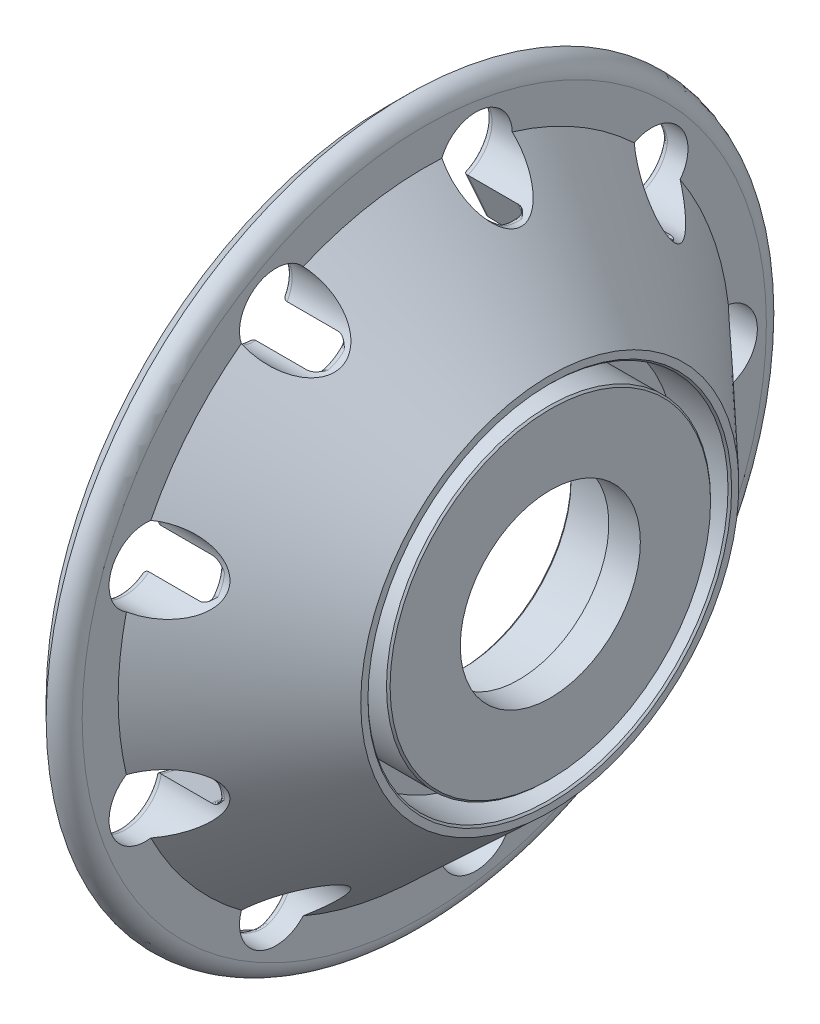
SolidWorks part; units mm, degrees
ref_plane "Plan de face" through (0, 0, 0) normal (0, 0, 1) x (1, 0, 0)
ref_plane "Plan de dessus" through (0, 0, 0) normal (0, 1, 0) x (1, 0, 0)
ref_plane "Plan de droite" through (0, 0, 0) normal (1, 0, 0) x (0, 0, -1)
ref_plane "Plan1" through (0, 0, 0) normal (0, 0, -1) x (-1, 0, 0)
sketch "Esquisse1" plane through (0, 0, 0) normal (0, 0, -1) x (-1, 0, 0)
  line L0 (0.0592, 21) -> (0.0592, 0)
  line L1 (0.0592, 0) -> (18, 0)
  line L2 (18, 0) -> (18, 38)
  line L3 (18, 38) -> (16, 40)
  line L4 (14, 38) -> (14, 34)
  line L5 (14, 34) -> (0.0592, 21)
  line L6 (0.0592, 0) -> (18, 0) construction
  arc A0 (16, 40) -> (14, 38) centre (16, 38) ccw
revolve "Révolution1" add sketch "Esquisse1" angle 360 about L6
sketch "Esquisse2" plane through (-18, 0, 0) normal (-1, 0, 0) x (0, 0, 1)
  line L0 (12.984, 26.489) -> (7.5426, 23.835)
  line L1 (7.5426, 23.835) -> (1.0643, 24.9773)
  line L2 (1.0643, 24.9773) -> (-3.1412, 29.3323)
  line L3 (-7.0805, 28.6377) -> (-9.5429, 23.107)
  line L4 (-9.5429, 23.107) -> (-15.2398, 19.8179)
  line L5 (-15.2398, 19.8179) -> (-21.2607, 20.4507)
  line L6 (-23.8319, 17.3865) -> (-22.1632, 11.567)
  line L7 (-22.1632, 11.567) -> (-24.4131, 5.3854)
  line L8 (-24.4131, 5.3854) -> (-29.4321, 2)
  line L9 (-29.4321, -2) -> (-24.4131, -5.3854)
  line L10 (-24.4131, -5.3854) -> (-22.1632, -11.567)
  line L11 (-22.1632, -11.567) -> (-23.8319, -17.3865)
  line L12 (-21.2607, -20.4507) -> (-15.2398, -19.8179)
  line L13 (-15.2398, -19.8179) -> (-9.5429, -23.107)
  line L14 (-9.5429, -23.107) -> (-7.0805, -28.6377)
  line L15 (-3.1412, -29.3323) -> (1.0643, -24.9773)
  line L16 (1.0643, -24.9773) -> (7.5426, -23.835)
  line L17 (7.5426, -23.835) -> (12.984, -26.489)
  line L18 (16.4481, -24.489) -> (16.8704, -18.4496)
  line L19 (16.8704, -18.4496) -> (21.0989, -13.4104)
  line L20 (21.0989, -13.4104) -> (26.9731, -11.9458)
  line L21 (28.3412, -8.187) -> (24.7827, -3.2891)
  line L22 (24.7827, -3.2891) -> (24.7827, 3.2891)
  line L23 (24.7827, 3.2891) -> (28.3412, 8.187)
  line L24 (26.9731, 11.9458) -> (21.0989, 13.4104)
  line L25 (21.0989, 13.4104) -> (16.8704, 18.4496)
  line L26 (16.8704, 18.4496) -> (16.4481, 24.489)
  arc A0 (-3.1412, 29.3323) -> (-7.0805, 28.6377) centre (-5.722, 32.4512) cw
  arc A1 (-21.2607, 20.4507) -> (-23.8319, 17.3865) centre (-25.2425, 21.181) cw
  arc A2 (-29.4321, 2) -> (-29.4321, -2) centre (-32.9518, 0) cw
  arc A3 (-23.8319, -17.3865) -> (-21.2607, -20.4507) centre (-25.2425, -21.181) cw
  arc A4 (-7.0805, -28.6377) -> (-3.1412, -29.3323) centre (-5.722, -32.4512) cw
  arc A5 (12.984, -26.489) -> (16.4481, -24.489) centre (16.4759, -28.5371) cw
  arc A6 (26.9731, -11.9458) -> (28.3412, -8.187) centre (30.9646, -11.2702) cw
  arc A7 (28.3412, 8.187) -> (26.9731, 11.9458) centre (30.9646, 11.2702) cw
  arc A8 (16.4481, 24.489) -> (12.984, 26.489) centre (16.4759, 28.5371) cw
extrude "Extrusion1" cut sketch "Esquisse2" against normal blind 8
draft "Dépouille1" type of draft neutral plane draft angle 2 faces to draft 9 parameters "D1"=2
ref_plane "Plan2" through (0, 28.5371, 0) normal (0, 1, 0) x (-1, 0, 0)
sketch "Esquisse3" plane through (0, 28.5371, 0) normal (0, 1, 0) x (-1, 0, 0)
  line L0 (8.5348, 16.4759) -> (8.5348, 12.4277)
  line L1 (8.5348, 12.4277) -> (14, 12.4277)
  line L2 (14, 12.4277) -> (14, 16.4759)
  line L3 (14, 16.4759) -> (8.5348, 16.4759)
  line L4 (14, 16.4759) -> (8.5348, 16.4759) construction
revolve "Révolution2" add sketch "Esquisse3" angle 360 about L3
ref_plane "Plan3" through (0, 0, 0) normal (0, 0.9397, 0.342) x (-1, 0, 0)
sketch "Esquisse4" plane through (0, 0, 0) normal (0, 0.9397, 0.342) x (-1, 0, 0)
  line L0 (8.5348, 37) -> (8.5348, 32.9518)
  line L1 (8.5348, 32.9518) -> (14, 32.9518)
  line L2 (14, 32.9518) -> (14, 37)
  line L3 (14, 37) -> (8.5348, 37)
  line L4 (8.5348, 32.9518) -> (14, 32.9518) construction
revolve "Révolution3" add sketch "Esquisse4" angle 360 about L1
ref_plane "Plan4" through (0, 0, 0) normal (0, 0.5, 0.866) x (1, 0, 0)
sketch "Esquisse5" plane through (0, 0, 0) normal (0, 0.5, 0.866) x (1, 0, 0)
  line L0 (-8.5348, -37) -> (-8.5348, -32.9518)
  line L1 (-8.5348, -32.9518) -> (-14, -32.9518)
  line L2 (-14, -32.9518) -> (-14, -37)
  line L3 (-14, -37) -> (-8.5348, -37)
  line L4 (-8.5348, -32.9518) -> (-14, -32.9518) construction
revolve "Révolution4" add sketch "Esquisse5" angle 360 about L4
ref_plane "Plan5" through (0, 0, 0) normal (0, -0.1736, 0.9848) x (1, 0, 0)
sketch "Esquisse6" plane through (0, 0, 0) normal (0, -0.1736, 0.9848) x (1, 0, 0)
  line L0 (-8.5348, -37) -> (-8.5348, -32.9518)
  line L1 (-8.5348, -32.9518) -> (-14, -32.9518)
  line L2 (-14, -32.9518) -> (-14, -37)
  line L3 (-14, -37) -> (-8.5348, -37)
  line L4 (-8.5348, -32.9518) -> (-14, -32.9518) construction
revolve "Révolution5" add sketch "Esquisse6" angle 360 about L1
ref_plane "Plan6" through (0, 0, 0) normal (0, 0.766, -0.6428) x (-1, 0, 0)
sketch "Esquisse7" plane through (0, 0, 0) normal (0, 0.766, -0.6428) x (-1, 0, 0)
  line L0 (8.5348, -28.9036) -> (8.5348, -32.9518)
  line L1 (8.5348, -32.9518) -> (14, -32.9518)
  line L2 (14, -32.9518) -> (14, -28.9036)
  line L3 (14, -28.9036) -> (8.5348, -28.9036)
  line L4 (8.5348, -32.9518) -> (14, -32.9518) construction
revolve "Révolution6" add sketch "Esquisse7" angle 360 about L1
sketch "Esquisse8" plane through (0, 0, 0) normal (0, 1, 0) x (1, 0, 0)
  line L0 (-8.5348, 32.9518) -> (-8.5348, 37)
  line L1 (-8.5348, 37) -> (-14, 37)
  line L2 (-14, 37) -> (-14, 32.9518)
  line L3 (-14, 32.9518) -> (-8.5348, 32.9518)
  line L4 (-14, 32.9518) -> (-8.5348, 32.9518) construction
revolve "Révolution7" add sketch "Esquisse8" angle 360 about L3
ref_plane "Plan7" through (0, 0, 0) normal (0, 0.766, 0.6428) x (-1, 0, 0)
sketch "Esquisse9" plane through (0, 0, 0) normal (0, 0.766, 0.6428) x (-1, 0, 0)
  line L0 (8.5348, -32.9518) -> (8.5348, -37)
  line L1 (8.5348, -37) -> (14, -37)
  line L2 (14, -37) -> (14, -32.9518)
  line L3 (14, -32.9518) -> (8.5348, -32.9518)
  line L4 (14, -32.9518) -> (8.5348, -32.9518) construction
revolve "Révolution8" add sketch "Esquisse9" angle 360 about L3
ref_plane "Plan8" through (0, 0, 0) normal (0, 0.1736, 0.9848) x (1, 0, 0)
sketch "Esquisse10" plane through (0, 0, 0) normal (0, 0.1736, 0.9848) x (1, 0, 0)
  line L0 (-8.5348, 28.9036) -> (-8.5348, 32.9518)
  line L1 (-8.5348, 32.9518) -> (-14, 32.9518)
  line L2 (-14, 32.9518) -> (-14, 28.9036)
  line L3 (-14, 28.9036) -> (-8.5348, 28.9036)
  line L4 (-8.5348, 32.9518) -> (-14, 32.9518) construction
revolve "Révolution9" add sketch "Esquisse10" angle 360 about L4
ref_plane "Plan9" through (0, 0, 0) normal (0, 0.9397, -0.342) x (-1, 0, 0)
sketch "Esquisse11" plane through (0, 0, 0) normal (0, 0.9397, -0.342) x (-1, 0, 0)
  line L0 (8.5348, 37) -> (8.5348, 32.9518)
  line L1 (8.5348, 32.9518) -> (14, 32.9518)
  line L2 (14, 32.9518) -> (14, 37)
  line L3 (14, 37) -> (8.5348, 37)
  line L4 (8.5348, 32.9518) -> (14, 32.9518) construction
revolve "Révolution10" add sketch "Esquisse11" angle 360 about L1
hole_wizard "Perçage1" positions "Esquisse13" profile "Esquisse12" legacy
sketch "Esquisse13" plane through (-0.0592, 0, 0) normal (1, 0, 0) x (0, 0, -1)
  point P0 (0, 0)
sketch "Esquisse12" plane through (-0.0592, 0, 0) normal (0, 1, 0) x (0, 0, -1)
  line L0 (0, 0) -> (0, 5.9408)
  line L1 (0, 5.9408) -> (20, 5.9408)
  line L2 (20, 5.9408) -> (20, 0)
  line L3 (20, 0) -> (0, 0)
  line L4 (0, 110) -> (0, -10) construction
  dimension "Diamètre" = 40
  dimension "Profondeur" = 5.9408
sketch "Esquisse14" plane through (0, 0, 0) normal (0, 1, 0) x (1, 0, 0)
  line L0 (-18, 37) -> (-18, 0)
  line L1 (-18, 0) -> (-17, 0)
  line L2 (-17, 0) -> (-17, 37)
  line L3 (-17, 37) -> (-18, 37)
  line L4 (-18, 0) -> (-17, 0) construction
revolve "Enlèvement de matière-Révolution1" cut sketch "Esquisse14" angle 360 about L1
ref_plane "Plan10" through (0, 0, 16.4759) normal (0, 0, 1) x (1, 0, 0)
sketch "Esquisse15" plane through (0, 0, 16.4759) normal (0, 0, 1) x (1, 0, 0)
  line L0 (-17, 32.5853) -> (-17, 28.5371)
  line L1 (-17, 28.5371) -> (-8.5348, 28.5371)
  line L2 (-8.5348, 28.5371) -> (-8.5348, 32.5853)
  line L3 (-8.5348, 32.5853) -> (-17, 32.5853)
  line L4 (-17, 28.5371) -> (-8.5348, 28.5371) construction
revolve "Enlèvement de matière-Révolution2" cut sketch "Esquisse15" angle 360 about L1
ref_plane "Plan11" through (0, 0, 30.9646) normal (0, 0, 1) x (1, 0, 0)
sketch "Esquisse16" plane through (0, 0, 30.9646) normal (0, 0, 1) x (1, 0, 0)
  line L0 (-17, 15.3184) -> (-17, 11.2702)
  line L1 (-17, 11.2702) -> (-8.5348, 11.2702)
  line L2 (-8.5348, 11.2702) -> (-8.5348, 15.3184)
  line L3 (-8.5348, 15.3184) -> (-17, 15.3184)
  line L4 (-17, 11.2702) -> (-8.5348, 11.2702) construction
revolve "Enlèvement de matière-Révolution3" cut sketch "Esquisse16" angle 360 about L1
ref_plane "Plan12" through (0, 0, 30.9646) normal (0, 0, 1) x (1, 0, 0)
sketch "Esquisse17" plane through (0, 0, 30.9646) normal (0, 0, 1) x (1, 0, 0)
  line L0 (-17, -7.222) -> (-17, -11.2702)
  line L1 (-17, -11.2702) -> (-8.5348, -11.2702)
  line L2 (-8.5348, -11.2702) -> (-8.5348, -7.222)
  line L3 (-8.5348, -7.222) -> (-17, -7.222)
  line L4 (-17, -11.2702) -> (-8.5348, -11.2702) construction
revolve "Enlèvement de matière-Révolution4" cut sketch "Esquisse17" angle 360 about L1
ref_plane "Plan13" through (0, 0, 16.4759) normal (0, 0, 1) x (1, 0, 0)
sketch "Esquisse18" plane through (0, 0, 16.4759) normal (0, 0, 1) x (1, 0, 0)
  line L0 (-17, -24.4889) -> (-17, -28.5371)
  line L1 (-17, -28.5371) -> (-8.5348, -28.5371)
  line L2 (-8.5348, -28.5371) -> (-8.5348, -24.4889)
  line L3 (-8.5348, -24.4889) -> (-17, -24.4889)
  line L4 (-17, -28.5371) -> (-8.5348, -28.5371) construction
revolve "Enlèvement de matière-Révolution5" cut sketch "Esquisse18" angle 360 about L1
ref_plane "Plan14" through (0, 0, -5.722) normal (0, 0, 1) x (1, 0, 0)
sketch "Esquisse19" plane through (0, 0, -5.722) normal (0, 0, 1) x (1, 0, 0)
  line L0 (-17, -28.403) -> (-17, -32.4512)
  line L1 (-17, -32.4512) -> (-8.5348, -32.4512)
  line L2 (-8.5348, -32.4512) -> (-8.5348, -28.403)
  line L3 (-8.5348, -28.403) -> (-17, -28.403)
  line L4 (-17, -32.4512) -> (-8.5348, -32.4512) construction
revolve "Enlèvement de matière-Révolution6" cut sketch "Esquisse19" angle 360 about L1
ref_plane "Plan15" through (0, 0, -25.2425) normal (0, 0, 1) x (1, 0, 0)
sketch "Esquisse20" plane through (0, 0, -25.2425) normal (0, 0, 1) x (1, 0, 0)
  line L0 (-17, -17.1328) -> (-17, -21.181)
  line L1 (-17, -21.181) -> (-8.5348, -21.181)
  line L2 (-8.5348, -21.181) -> (-8.5348, -17.1328)
  line L3 (-8.5348, -17.1328) -> (-17, -17.1328)
  line L4 (-17, -21.181) -> (-8.5348, -21.181) construction
revolve "Enlèvement de matière-Révolution7" cut sketch "Esquisse20" angle 360 about L1
ref_plane "Plan16" through (0, 0, -32.9518) normal (0, 0, 1) x (1, 0, 0)
sketch "Esquisse21" plane through (0, 0, -32.9518) normal (0, 0, 1) x (1, 0, 0)
  line L0 (-17, 4.0482) -> (-17, 0)
  line L1 (-17, 0) -> (-8.5348, 0)
  line L2 (-8.5348, 0) -> (-8.5348, 4.0482)
  line L3 (-8.5348, 4.0482) -> (-17, 4.0482)
  line L4 (-17, 0) -> (-8.5348, 0) construction
revolve "Enlèvement de matière-Révolution8" cut sketch "Esquisse21" angle 360 about L1
ref_plane "Plan17" through (0, 0, -25.2425) normal (0, 0, 1) x (1, 0, 0)
sketch "Esquisse22" plane through (0, 0, -25.2425) normal (0, 0, 1) x (1, 0, 0)
  line L0 (-17, 25.2292) -> (-17, 21.181)
  line L1 (-17, 21.181) -> (-8.5348, 21.181)
  line L2 (-8.5348, 21.181) -> (-8.5348, 25.2292)
  line L3 (-8.5348, 25.2292) -> (-17, 25.2292)
  line L4 (-17, 21.181) -> (-8.5348, 21.181) construction
revolve "Enlèvement de matière-Révolution9" cut sketch "Esquisse22" angle 360 about L1
ref_plane "Plan18" through (0, 0, -5.722) normal (0, 0, 1) x (1, 0, 0)
sketch "Esquisse23" plane through (0, 0, -5.722) normal (0, 0, 1) x (1, 0, 0)
  line L0 (-17, 36.4994) -> (-17, 32.4512)
  line L1 (-17, 32.4512) -> (-8.5348, 32.4512)
  line L2 (-8.5348, 32.4512) -> (-8.5348, 36.4994)
  line L3 (-8.5348, 36.4994) -> (-17, 36.4994)
  line L4 (-17, 32.4512) -> (-8.5348, 32.4512) construction
revolve "Enlèvement de matière-Révolution10" cut sketch "Esquisse23" angle 360 about L1
sketch "Esquisse24" plane through (0, 0, 0) normal (0, 0, -1) x (-1, 0, 0)
  line L0 (0, 18) -> (0, 0)
  line L1 (0, 0) -> (6, 0)
  line L2 (6, 0) -> (6, 18)
  line L3 (6, 18) -> (0, 18)
  line L4 (0, 0) -> (6, 0) construction
revolve "Révolution11" add sketch "Esquisse24" angle 360 about L1
fillet "Congé7" radius 0.75 9 edges at (-10, 25.0312, 14.4518) (-10, 0, -28.9036) (-10, -18.5789, -22.1414) (-10, -28.4645, -5.0191) (-10, -25.0312, 14.4518) (-10, -9.8856, 27.1605) (-10, 9.8856, 27.1605) (-10, 18.5789, -22.1414) (-10, 28.4645, -5.0191)
fillet "Congé8" radius 0.75 45 edges at (-9.835, 26.3656, 12.7311) (-9.7175, 24.3253, 16.4596) (-10, 15.93, 18.9846) (-10, 12.769, 23.6712) (-10, 5.4339, 26.341) (-10, 0, 24.7827) (-10, -5.4339, 26.341) (-10, -12.769, 23.6712) (-10, -15.93, 18.9846) (-10, -21.0943, 16.6855) (-10, -24.9972, 9.9254) (-10, -24.4062, 4.3035) (-10, -26.8844, -0.7773) (-10, -25.5289, -8.4646) (-10, -21.4624, -12.3913) (-10, -20.095, -17.8764) (-10, -14.1154, -22.8939) (-10, -8.4762, -23.2881) (-10, -3.9029, -26.6109) (-10, 3.9029, -26.6109) (-10, 8.4762, -23.2881) (-10, 14.1154, -22.8939) (-10, 20.095, -17.8764) (-10, 21.4624, -12.3913) (-10, 25.5289, -8.4646) (-10, 26.8844, -0.7773) (-10, 24.4062, 4.3035) (-10, 24.9972, 9.9254) (-10, 21.0943, 16.6855) (-9.835, 17.116, -23.7543) (-9.7175, 20.4335, -21.0976) (-9.835, 28.3806, -7.1949) (-9.7175, 29.2143, -3.0273) (-9.835, 12.0138, 26.7001) (-9.7175, 8.0543, 28.2448) (-9.835, -7.9593, 28.1758) (-9.7175, -11.9854, 26.814) (-9.835, -24.2082, 16.4677) (-9.7175, -26.4171, 12.8366) (-9.835, -29.1299, -2.9457) (-9.7175, -28.4878, -7.1472) (-9.835, -20.4213, -20.9809) (-9.7175, -17.2288, -23.7867) (-9.835, -2.1574, -29.1988) (-9.7175, 2.0917, -29.2961)
hole_wizard "Perçage2" positions "Esquisse26" profile "Esquisse25" legacy
sketch "Esquisse26" plane through (-10, 0, 0) normal (-1, 0, 0) x (0, 0, 1)
  point P0 (0, 0)
sketch "Esquisse25" plane through (-10, 0, 0) normal (0, 1, 0) x (0, 0, 1)
  line L0 (0, 0) -> (0, 10)
  line L1 (0, 10) -> (10, 10)
  line L2 (10, 10) -> (10, 6.5)
  line L3 (10, 6.5) -> (12, 6.5)
  line L4 (12, 6.5) -> (12, 0)
  line L5 (12, 0) -> (0, 0)
  line L6 (0, 110) -> (0, -10) construction
  dimension "Diamètre" = 20
  dimension "Profondeur" = 10
  dimension "Diamètre chambrage" = 24
  dimension "Profondeur chambrage" = 6.5
chamfer "Chanfrein1" distance 0.2 angle 45 1 edges at (0, 0, 18)
chamfer "Chanfrein2" distance 0.2 angle 45 1 edges at (-0.0592, 0, -20)
hole_wizard "Trou taraudé M25" positions "Esquisse3D3" profile "Esquisse35" tap size "M2" standard "ISO"
sketch3d "Esquisse3D3"
  line L0 (6.631, 0, 0) -> (-61.2619, 0, 0) construction
  point P0 (-10, 0, -16)
  dimension "D1" = 16
sketch "Esquisse35" plane through (-10, 0, -16) normal (0, 1, 0) x (0, 0, 1)
  line L0 (0, 0) -> (0, 8.4807)
  line L1 (0, 8.4807) -> (0.8, 8)
  line L2 (0.8, 8) -> (0.8, 0)
  line L5 (0.8, 0) -> (0, 0)
  line L10 (0, 8.4807) -> (-0.8, 8) construction
  line L11 (0, -6.35) -> (0, 107.95) construction
  dimension "Diamètre du trou pour taraudage" = 1.6
  dimension "Profondeur du trou pour taraudage" = 8
  dimension "Angle de pointe" = 118
hole_wizard "Trou taraudé M22" positions "Esquisse28" profile "Esquisse27" tap size "M2" standard "ISO"
sketch "Esquisse28" plane through (-10, 0, 0) normal (-1, 0, 0) x (0, 0, 1)
  point P0 (8, -13.8564)
sketch "Esquisse27" plane through (-10, -13.8564, 8) normal (0, 1, 0) x (0, 0, 1)
  line L0 (0, 0) -> (0, 8.4807)
  line L1 (0, 8.4807) -> (0.8, 8)
  line L2 (0.8, 8) -> (0.8, 0)
  line L5 (0.8, 0) -> (0, 0)
  line L10 (0, 8.4807) -> (-0.8, 8) construction
  line L11 (0, -6.35) -> (0, 107.95) construction
  dimension "Diamètre du trou pour taraudage" = 1.6
  dimension "Profondeur du trou pour taraudage" = 8
  dimension "Angle de pointe" = 118
hole_wizard "Trou taraudé M26" positions "Esquisse30" profile "Esquisse29" tap size "M2" standard "ISO"
sketch "Esquisse30" plane through (-10, 0, 0) normal (-1, 0, 0) x (0, 0, 1)
  point P0 (8, 13.8564)
sketch "Esquisse29" plane through (-10, 13.8564, 8) normal (0, 1, 0) x (0, 0, 1)
  line L0 (0, 0) -> (0, 8.4807)
  line L1 (0, 8.4807) -> (0.8, 8)
  line L2 (0.8, 8) -> (0.8, 0)
  line L5 (0.8, 0) -> (0, 0)
  line L10 (0, 8.4807) -> (-0.8, 8) construction
  line L11 (0, -6.35) -> (0, 107.95) construction
  dimension "Diamètre du trou pour taraudage" = 1.6
  dimension "Profondeur du trou pour taraudage" = 8
  dimension "Angle de pointe" = 118
chamfer "Chanfrein3" distance 0.3 angle 45 1 edges at (-10, 0, 12)
fillet "Congé1" radius 0.2 1 edges at (-3.5, 0, 12)
fillet "Congé9" radius 0.75 9 edges at (-17, 23.7831, 28.3436) (-17, 0, 37) (-17, -23.7831, 28.3436) (-17, -36.4379, 6.425) (-17, -32.0429, -18.5) (-17, -12.6547, -34.7686) (-17, 12.6547, -34.7686) (-17, 32.0429, -18.5) (-17, 36.4379, 6.425)
fillet "Congé12" radius 0.75 63 edges at (-17.0931, -22.1085, -29.1831) (-17.0931, -24.9006, -26.8402) (-17, -17.9096, -27.627) (-17, -24.0973, -22.4349) (-17.0931, 1.8224, -36.5666) (-17.0931, 22.1085, -29.1831) (-17.0931, 24.9006, -26.8402) (-17.0931, 35.6946, -8.1444) (-17.0931, 36.3275, -4.555) (-17.0931, 32.5788, 16.7051) (-17.0931, 30.7564, 19.8615) (-17.0931, 14.219, 33.7381) (-17.0931, 10.794, 34.9847) (-17.0931, -10.794, 34.9847) (-17.0931, -14.219, 33.7381) (-17.0931, -30.7564, 19.8615) (-17.0931, -32.5788, 16.7051) (-17.0931, -36.3275, -4.555) (-17.0931, -1.8224, -36.5666) (-17.0931, -35.6946, -8.1444) (-17, 14.6766, -23.0548) (-17, 8.5598, -23.5178) (-17, 3.5764, -27.095) (-17, 4.0388, -32.6756) (-17, 17.9096, -27.627) (-17, 26.0623, -8.2271) (-17, 21.6741, -12.5136) (-17, 20.156, -18.4571) (-17, 24.0973, -22.4349) (-17, 31.4778, -9.6515) (-17, 25.2532, 10.4502) (-17, 24.6469, 4.3459) (-17, 27.3044, -1.1829) (-17, 32.8805, -1.6966) (-17, 30.3173, 12.8401) (-17, 12.6278, 24.2377) (-17, 16.0871, 19.1719) (-17, 21.6767, 16.6448) (-17, 26.2785, 19.8355) (-17, 14.9709, 29.3237) (-17, -5.9063, 26.6842) (-17, 0, 25.0271) (-17, 5.9063, 26.6842) (-17, 7.3805, 32.0863) (-17, -7.3805, 32.0863) (-17, -21.6767, 16.6448) (-17, -16.0871, 19.1719) (-17, -12.6278, 24.2377) (-17, -14.9709, 29.3237) (-17, -26.2785, 19.8355) (-17, -27.3044, -1.1829) (-17, -24.6469, 4.3459) (-17, -25.2532, 10.4502) (-17, -30.3173, 12.8401) (-17, -32.8805, -1.6966) (-17, -3.5764, -27.095) (-17, -8.5598, -23.5178) (-17, -14.6766, -23.0548) (-17, -4.0388, -32.6756) (-17, -20.156, -18.4571) (-17, -21.6741, -12.5136) (-17, -26.0623, -8.2271) (-17, -31.4778, -9.6515)
